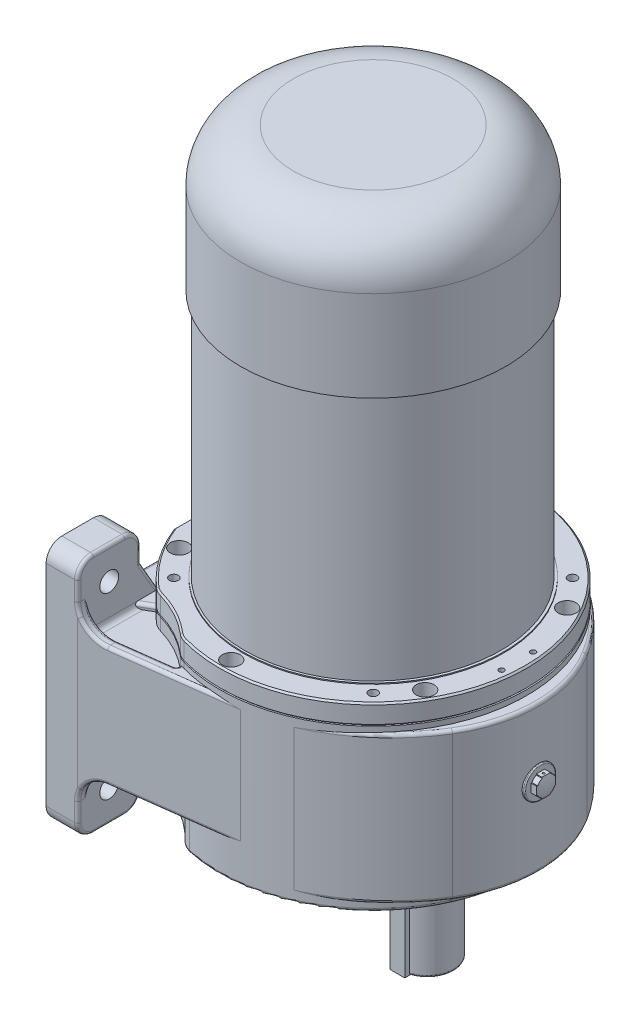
SolidWorks part; units mm, degrees
ref_plane "前视基准面" through (0, 0, 0) normal (0, 0, 1) x (1, 0, 0)
ref_plane "上视基准面" through (0, 0, 0) normal (0, 1, 0) x (1, 0, 0)
ref_plane "右视基准面" through (0, 0, 0) normal (1, 0, 0) x (0, 0, -1)
imported_body "50箱盖-1-surface1"
imported_body "卧式箱体-1-surface1"
imported_body "卧式箱体-1-surface2"
imported_body "卧式箱体-1-surface3"
imported_body "复件 5034.2200.106-00-1-surface2"
imported_body "复件 5034.2200.106-00-1-surface3"
imported_body "复件 5034.2200.106-00-1-surface4"
imported_body "复件 5034.2200.106-00-1-surface5"
imported_body "复件 5034.2200.106-00-1-surface6"
imported_body "复件 5034.2200.106-00-1-surface7"
imported_body "复件 5034.2200.106-00-1-surface8"
imported_body "复件 5034.2200.106-00-1-surface9"
imported_body "复件 5034.2200.106-00-1-surface10"
imported_body "复件 5034.2200.106-00-1-surface11"
imported_body "复件 5034.2200.106-00-1-surface12"
imported_body "复件 5034.2200.106-00-1-surface13"
imported_body "复件 5034.2200.106-00-1-surface14"
imported_body "复件 5034.2200.106-00-1-surface15"
imported_body "复件 5034.2200.106-00-1-surface16"
imported_body "复件 5034.2200.106-00-1-surface17"
imported_body "复件 5034.2200.106-00-1-surface18"
imported_body "复件 5034.2200.106-00-1-surface19"
imported_body "复件 5034.2200.106-00-1-surface20"
imported_body "复件 5034.2200.106-00-1-surface21"
imported_body "复件 5034.2200.106-00-1-surface22"
imported_body "复件 5034.2200.106-00-1-surface23"
imported_body "复件 5034.2200.106-00-1-surface24"
imported_body "复件 5034.2200.106-00-1-surface25"
imported_body "复件 5034.2200.106-00-1-surface26"
imported_body "复件 5034.2200.106-00-1-surface27"
imported_body "复件 5034.2200.106-00-1-surface28"
imported_body "复件 5034.2200.106-00-1-surface29"
imported_body "复件 5034.2200.106-00-1-surface30"
imported_body "复件 5034.2200.106-00-1-surface31"
imported_body "复件 5034.2200.106-00-1-surface32"
imported_body "复件 5034.2200.106-00-1-surface33"
imported_body "复件 5034.2200.106-00-1-surface34"
imported_body "复件 5034.2200.106-00-1-surface35"
imported_body "复件 5034.2200.106-00-1-surface36"
imported_body "复件 5034.2200.106-00-1-surface37"
imported_body "复件 5034.2200.106-00-1-surface38"
imported_body "复件 5034.2200.106-00-1-surface39"
imported_body "复件 5034.2200.106-00-1-surface40"
imported_body "复件 5034.2200.106-00-1-surface41"
imported_body "复件 5034.2200.106-00-1-surface42"
imported_body "复件 5034.2200.106-00-1-surface43"
imported_body "复件 5034.2200.106-00-1-surface44"
imported_body "复件 5034.2200.106-00-1-surface45"
imported_body "复件 5034.2200.106-00-1-surface46"
imported_body "复件 5034.2200.106-00-1-surface47"
imported_body "复件 5034.2200.106-00-1-surface48"
imported_body "复件 5034.2200.106-00-1-surface49"
imported_body "复件 5034.2200.106-00-1-surface50"
imported_body "复件 5034.2200.106-00-1-surface51"
imported_body "复件 5034.2200.106-00-1-surface52"
imported_body "复件 5034.2200.106-00-1-surface53"
imported_body "复件 5034.2200.106-00-1-surface54"
imported_body "复件 5034.2200.106-00-1-surface55"
imported_body "复件 5034.2200.106-00-1-surface56"
imported_body "复件 5034.2200.106-00-1-surface57"
imported_body "复件 5034.2200.106-00-1-surface58"
imported_body "复件 5034.2200.106-00-1-surface59"
imported_body "复件 5034.2200.106-00-1-surface60"
imported_body "复件 5034.2200.106-00-1-surface61"
imported_body "透气塞-1-surface1"
sketch "草图1" plane through (0, -196.7551, 0) normal (0, 1, 0) x (1, 0, 0)
  circle A0 centre (15.5509, 127.454) radius 122
  circle A1 centre (67.5509, 127.454) radius 52 construction
extrude "凸台-拉伸1" add sketch "草图1" along normal blind 237
sketch "草图2" plane through (0, 40.2449, 0) normal (0, 1, 0) x (1, 0, 0)
  circle A0 centre (16.0509, 127.454) radius 126
extrude "凸台-拉伸2" add sketch "草图2" along normal blind 136 separate body
fillet "圆角1" radius 50 1 edges at (16.0509, 176.2449, -1.454)
